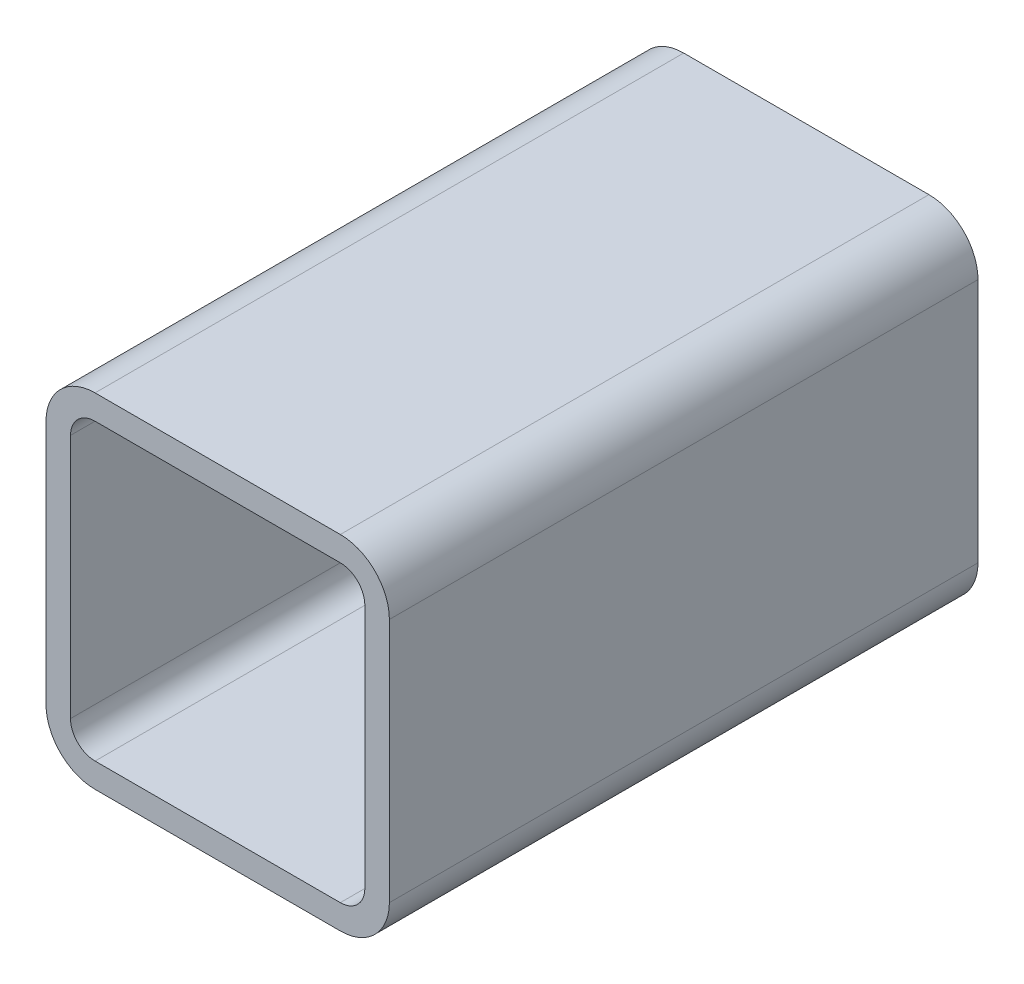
SolidWorks part; units mm, degrees
ref_plane "Front Plane" through (0, 0, 0) normal (0, 0, 1) x (1, 0, 0)
ref_plane "Top Plane" through (0, 0, 0) normal (0, 1, 0) x (1, 0, 0)
ref_plane "Right Plane" through (0, 0, 0) normal (1, 0, 0) x (0, 0, -1)
sketch "Sketch1" plane through (0, 0, 0) normal (0, 0, 1) x (1, 0, 0)
sketch_block_instance "HSS7x7x0.500-1"
sketch_block "HSS7x7x0.500"
extrude "Boss-Extrude1" add sketch "Sketch1" along normal blind 304.8
